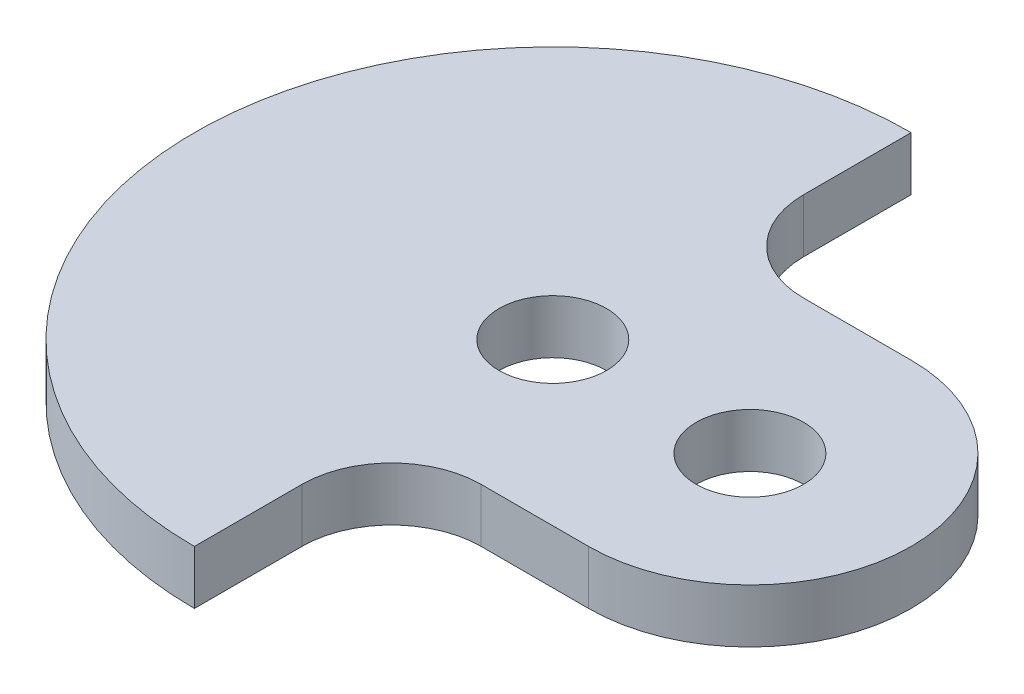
SolidWorks part; units mm, degrees
ref_plane "Front" through (0, 0, 0) normal (0, 0, 1) x (1, 0, 0)
ref_plane "Top" through (0, 0, 0) normal (0, 1, 0) x (1, 0, 0)
ref_plane "Right" through (0, 0, 0) normal (1, 0, 0) x (0, 0, -1)
sketch "Sketch1" plane through (0, 0, 0) normal (0, 1, 0) x (1, 0, 0)
  line L0 (39.6668, 9) -> (45.6668, 9)
  line L1 (34.6668, 14) -> (34.6668, 20)
  line L3 (34.6668, -20) -> (34.6668, -14)
  line L4 (39.6668, -9) -> (45.6668, -9)
  arc A0 (34.6668, 20) -> (34.6668, -20) centre (34.6668, 0) ccw
  circle A1 centre (34.6668, 0) radius 3
  circle A2 centre (45.6668, 0) radius 3
  arc A3 (39.6668, 9) -> (34.6668, 14) centre (39.6668, 14) cw
  arc A4 (34.6668, -14) -> (39.6668, -9) centre (39.6668, -14) cw
  arc A5 (45.6668, -9) -> (45.6668, 9) centre (45.6668, 0) ccw
  point P7 (34.6668, 9)
extrude "Extrude1" add sketch "Sketch1" along normal blind 3
